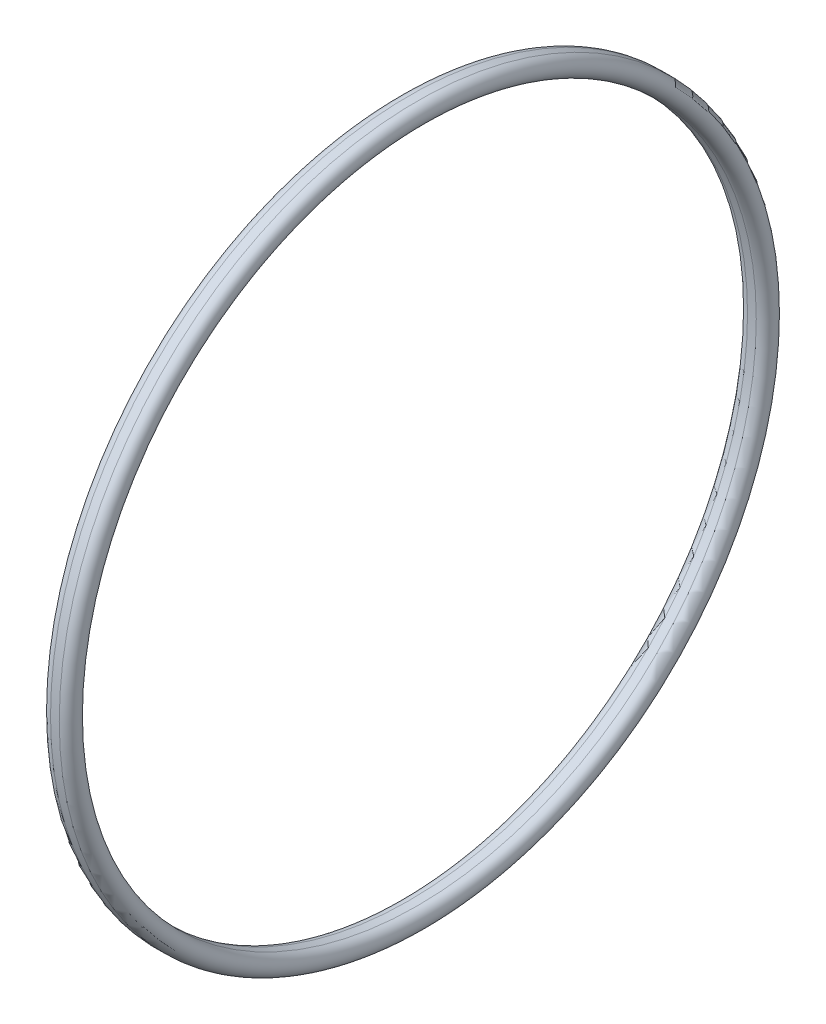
SolidWorks part; units mm, degrees
ref_plane "Face" through (0, 0, 0) normal (0, 0, 1) x (1, 0, 0)
ref_plane "Cote" through (0, 0, 0) normal (0, 1, 0) x (1, 0, 0)
ref_plane "Dessus" through (0, 0, 0) normal (1, 0, 0) x (0, 0, -1)
sketch "Esquisse1" plane through (0, 0, 0) normal (0, 0, 1) x (1, 0, 0)
  line L0 (0, 0) -> (20.5455, 0) construction
  line L1 (-0.625, 48.55) -> (0.625, 48.55)
  line L2 (0.625, 51.3) -> (-0.625, 51.3)
  line L3 (-2, 49.925) -> (2, 49.925) construction
  line L4 (0, 49.925) -> (0, 44.2668) construction
  line L5 (0, -50) -> (0, 50) construction
  arc A0 (0.625, 48.55) -> (0.625, 51.3) centre (0.625, 49.925) ccw
  arc A1 (-0.625, 51.3) -> (-0.625, 48.55) centre (-0.625, 49.925) ccw
  dimension "Ø F" = 97.1
  dimension "Ø logement" = 102.6
  dimension "Larg" = 4
revolve "Base-Révolution" add sketch "Esquisse1" angle 360 about L0
ref_plane "Plan pour mis en place" through (2, 0, 0) normal (1, 0, 0) x (0, 0, -1)
